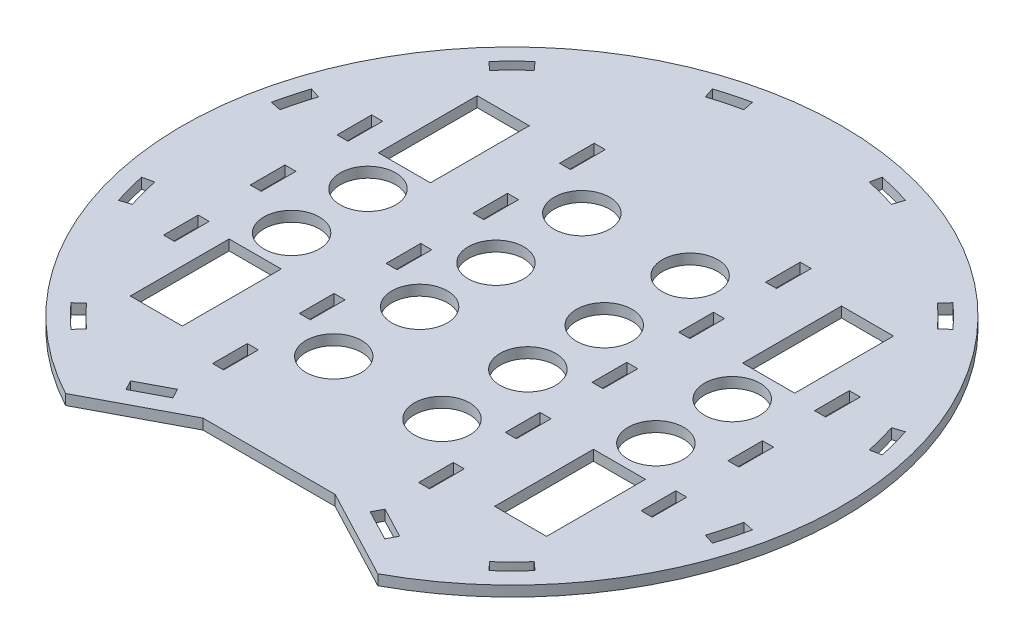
SolidWorks part; units mm, degrees
ref_plane "Front Plane" through (0, 0, 0) normal (0, 0, 1) x (1, 0, 0)
ref_plane "Top Plane" through (0, 0, 0) normal (0, 1, 0) x (1, 0, 0)
ref_plane "Right Plane" through (0, 0, 0) normal (1, 0, 0) x (0, 0, -1)
sketch "Sketch1" plane through (0, 0, 0) normal (0, 1, 0) x (1, 0, 0)
  line L0 (-106.3364, -157.4566) -> (-42.1421, -123.65) construction
  line L1 (-120, -100.0099) -> (-90, -100.0099)
  line L2 (-120, -100.0099) -> (-120, -43.0099)
  line L3 (-120, -43.0099) -> (-90, -43.0099)
  line L4 (-90, -100.0099) -> (-90, -43.0099)
  line L5 (-120, 43.0099) -> (-90, 43.0099)
  line L6 (-120, 43.0099) -> (-120, 100.0099)
  line L7 (-120, 100.0099) -> (-90, 100.0099)
  line L8 (-90, 43.0099) -> (-90, 100.0099)
  line L9 (90, 100.0099) -> (120, 100.0099)
  line L10 (90, 100.0099) -> (90, 43.0099)
  line L11 (90, 43.0099) -> (120, 43.0099)
  line L12 (120, 100.0099) -> (120, 43.0099)
  line L13 (120, -43.0099) -> (90, -43.0099)
  line L14 (120, -43.0099) -> (120, -100.0099)
  line L15 (120, -100.0099) -> (90, -100.0099)
  line L16 (90, -43.0099) -> (90, -100.0099)
  line L17 (-42.1421, -123.65) -> (42.1421, -123.65) construction
  line L18 (0, 190) -> (0, -190) construction
  line L19 (-105, 43.0099) -> (-105, -43.0099) construction
  line L20 (-190, 0) -> (190, 0) construction
  line L33 (140.85, -40) -> (140.85, -60)
  line L34 (-134.5, 40) -> (-140.85, 40)
  line L35 (-134.5, 40) -> (-134.5, 60)
  line L36 (-134.5, 60) -> (-140.85, 60)
  line L37 (-140.85, 40) -> (-140.85, 60)
  line L38 (-134.5, 10) -> (-140.85, 10)
  line L39 (-134.5, 10) -> (-134.5, -10)
  line L40 (-134.5, -10) -> (-140.85, -10)
  line L41 (-140.85, 10) -> (-140.85, -10)
  line L46 (-134.5, -40) -> (-140.85, -40)
  line L47 (-134.5, -40) -> (-134.5, -60)
  line L48 (-134.5, -60) -> (-140.85, -60)
  line L49 (-140.85, -40) -> (-140.85, -60)
  line L50 (134.5, -60) -> (140.85, -60)
  line L51 (134.5, -40) -> (134.5, -60)
  line L52 (134.5, -40) -> (140.85, -40)
  line L53 (140.85, 10) -> (140.85, -10)
  line L54 (134.5, -10) -> (140.85, -10)
  line L55 (134.5, 10) -> (134.5, -10)
  line L56 (134.5, 10) -> (140.85, 10)
  line L57 (140.85, 40) -> (140.85, 60)
  line L58 (134.5, 60) -> (140.85, 60)
  line L59 (134.5, 40) -> (134.5, 60)
  line L60 (134.5, 40) -> (140.85, 40)
  line L73 (42.1421, -123.65) -> (106.3364, -157.4566) construction
  line L86 (0, 0) -> (-37.4241, 176.0666) construction
  line L99 (-155.3051, -190) -> (147.1552, -190) construction
  line L100 (-128.4523, -140) -> (128.4523, -140) construction
  line L101 (-90, -167.332) -> (-38.1, -140)
  line L102 (-38.1, -140) -> (38.1, -140)
  line L103 (38.1, -140) -> (90, -167.332)
  line L104 (-53.6608, 165.151) -> (-55.6231, 171.1902)
  line L105 (0, 0) -> (-55.6231, 171.1902) construction
  line L126 (105, 43.0099) -> (105, -43.0099) construction
  line L127 (-37.4241, 176.0666) -> (-36.1039, 169.8553)
  line L128 (-100.2255, -161.4151) -> (-40.5722, -130) construction
  line L129 (-120.4435, 133.7661) -> (-116.1945, 129.0471)
  line L130 (-40.5722, -130) -> (40.5722, -130) construction
  line L131 (40.5722, -130) -> (100.2255, -161.4151) construction
  line L132 (-129.0471, 116.1945) -> (-133.7661, 120.4435)
  line L133 (-171.1902, 55.6231) -> (-165.151, 53.6608)
  line L134 (-169.8553, 36.1039) -> (-176.0666, 37.4241)
  line L135 (-176.0666, -37.4241) -> (-169.8553, -36.1039)
  line L136 (-165.151, -53.6608) -> (-171.1902, -55.6231)
  line L137 (-133.7661, -120.4435) -> (-129.0471, -116.1945)
  line L138 (-116.1945, -129.0471) -> (-120.4435, -133.7661)
  line L139 (0, 0) -> (-36.1039, 169.8553) construction
  line L140 (56.2033, -10) -> (62.5533, -10)
  line L141 (116.1945, -129.0471) -> (120.4435, -133.7661)
  line L142 (133.7661, -120.4435) -> (129.0471, -116.1945)
  line L143 (165.151, -53.6608) -> (171.1902, -55.6231)
  line L144 (176.0666, -37.4241) -> (169.8553, -36.1039)
  line L145 (169.8553, 36.1039) -> (176.0666, 37.4241)
  line L146 (171.1902, 55.6231) -> (165.151, 53.6608)
  line L147 (129.0471, 116.1945) -> (133.7661, 120.4435)
  line L148 (120.4435, 133.7661) -> (116.1945, 129.0471)
  line L149 (37.4241, 176.0666) -> (36.1039, 169.8553)
  line L150 (53.6608, 165.151) -> (55.6231, 171.1902)
  line L151 (-56.8793, -138.5878) -> (-59.8381, -132.9693)
  line L152 (-59.8381, -132.9693) -> (-77.5342, -142.2885)
  line L153 (-77.5342, -142.2885) -> (-74.5754, -147.907)
  line L154 (-74.5754, -147.907) -> (-56.8793, -138.5878)
  line L155 (77.5342, -142.2885) -> (74.5754, -147.907)
  line L156 (74.5754, -147.907) -> (56.8793, -138.5878)
  line L157 (56.8793, -138.5878) -> (59.8381, -132.9693)
  line L158 (59.8381, -132.9693) -> (77.5342, -142.2885)
  line L159 (-62.5533, 40) -> (-56.2033, 40)
  line L164 (-56.2033, 10) -> (-62.5533, 10)
  line L165 (-56.2033, 10) -> (-56.2033, -10)
  line L166 (-56.2033, -10) -> (-62.5533, -10)
  line L167 (-62.5533, 10) -> (-62.5533, -10)
  line L168 (-62.5533, 40) -> (-62.5533, 60)
  line L169 (-62.5533, 60) -> (-56.2033, 60)
  line L170 (-56.2033, 40) -> (-56.2033, 60)
  line L171 (-62.5533, 90) -> (-56.2033, 90)
  line L172 (-62.5533, 90) -> (-62.5533, 110)
  line L173 (-62.5533, 110) -> (-56.2033, 110)
  line L174 (-56.2033, 90) -> (-56.2033, 110)
  line L175 (-62.5533, -40) -> (-56.2033, -40)
  line L176 (-62.5533, -40) -> (-62.5533, -60)
  line L177 (-62.5533, -60) -> (-56.2033, -60)
  line L178 (-56.2033, -40) -> (-56.2033, -60)
  line L179 (-62.5533, -90) -> (-56.2033, -90)
  line L180 (-62.5533, -90) -> (-62.5533, -110)
  line L181 (-62.5533, -110) -> (-56.2033, -110)
  line L182 (-56.2033, -90) -> (-56.2033, -110)
  line L183 (62.5533, -60) -> (56.2033, -60)
  line L184 (56.2033, -40) -> (56.2033, -60)
  line L185 (62.5533, -40) -> (62.5533, -60)
  line L186 (62.5533, -40) -> (56.2033, -40)
  line L187 (62.5533, -110) -> (56.2033, -110)
  line L188 (62.5533, -90) -> (56.2033, -90)
  line L189 (56.2033, -90) -> (56.2033, -110)
  line L190 (62.5533, -90) -> (62.5533, -110)
  line L191 (56.2033, 90) -> (56.2033, 110)
  line L192 (62.5533, 110) -> (56.2033, 110)
  line L193 (62.5533, 90) -> (62.5533, 110)
  line L194 (62.5533, 90) -> (56.2033, 90)
  line L195 (56.2033, 40) -> (56.2033, 60)
  line L196 (62.5533, 60) -> (56.2033, 60)
  line L197 (62.5533, 40) -> (62.5533, 60)
  line L198 (62.5533, 10) -> (62.5533, -10)
  line L199 (56.2033, 10) -> (56.2033, -10)
  line L200 (56.2033, 10) -> (62.5533, 10)
  line L201 (62.5533, 40) -> (56.2033, 40)
  line L202 (-134.5, -60) -> (-134.5, -109.8366) construction
  line L203 (-134.5, 60) -> (-134.5, 109.8366) construction
  line L204 (-56.2033, 110) -> (-56.2033, 164.3031) construction
  line L205 (-56.2033, -110) -> (-56.2033, -131.0551) construction
  circle A0 centre (0, 0) radius 190 construction
  arc A3 (-90, -167.332) -> (90, -167.332) centre (0, 0) cw
  circle A4 centre (-105, -22.0099) radius 16
  circle A5 centre (-105, 22.0099) radius 16
  circle A6 centre (105, 22.0099) radius 16
  circle A7 centre (105, -22.0099) radius 16
  circle A16 centre (0, 0) radius 180 construction
  circle A17 centre (0, 0) radius 173.65 construction
  arc A18 (-55.6231, 171.1902) -> (-37.4241, 176.0666) centre (0, 0) cw
  arc A19 (-53.6608, 165.151) -> (-36.1039, 169.8553) centre (0, 0) cw
  arc A20 (-133.7661, 120.4435) -> (-120.4435, 133.7661) centre (0, 0) cw
  arc A21 (-129.0471, 116.1945) -> (-116.1945, 129.0471) centre (0, 0) cw
  arc A22 (-176.0666, 37.4241) -> (-171.1902, 55.6231) centre (0, 0) cw
  arc A23 (-169.8553, 36.1039) -> (-165.151, 53.6608) centre (0, 0) cw
  arc A24 (-171.1902, -55.6231) -> (-176.0666, -37.4241) centre (0, 0) cw
  arc A25 (-165.151, -53.6608) -> (-169.8553, -36.1039) centre (0, 0) cw
  arc A26 (-120.4435, -133.7661) -> (-133.7661, -120.4435) centre (0, 0) cw
  arc A27 (-116.1945, -129.0471) -> (-129.0471, -116.1945) centre (0, 0) cw
  arc A28 (120.4435, -133.7661) -> (133.7661, -120.4435) centre (0, 0) ccw
  arc A29 (116.1945, -129.0471) -> (129.0471, -116.1945) centre (0, 0) ccw
  arc A30 (165.151, -53.6608) -> (169.8553, -36.1039) centre (0, 0) ccw
  arc A31 (171.1902, -55.6231) -> (176.0666, -37.4241) centre (0, 0) ccw
  arc A32 (176.0666, 37.4241) -> (171.1902, 55.6231) centre (0, 0) ccw
  arc A33 (169.8553, 36.1039) -> (165.151, 53.6608) centre (0, 0) ccw
  arc A34 (133.7661, 120.4435) -> (120.4435, 133.7661) centre (0, 0) ccw
  arc A35 (129.0471, 116.1945) -> (116.1945, 129.0471) centre (0, 0) ccw
  arc A36 (53.6608, 165.151) -> (36.1039, 169.8553) centre (0, 0) ccw
  arc A37 (55.6231, 171.1902) -> (37.4241, 176.0666) centre (0, 0) ccw
  circle A38 centre (-31.2033, 22.0099) radius 16
  circle A39 centre (-31.2033, 71.5099) radius 16
  circle A40 centre (-31.2033, -22.0099) radius 16
  circle A41 centre (-31.2033, -71.5099) radius 16
  circle A42 centre (31.2033, -71.5099) radius 16
  circle A43 centre (31.2033, -22.0099) radius 16
  circle A44 centre (31.2033, 71.5099) radius 16
  circle A45 centre (31.2033, 22.0099) radius 16
  point P71 (-59.3783, 90)
  point P116 (0, -140)
  point P166 (-90, -71.5099)
  point P168 (-90, 71.5099)
  point P182 (0, 0)
  point P184 (-56.2033, 164.3031)
  point P194 (0, 0)
  point P195 (-56.2033, -131.0551)
  point P199 (-56.2033, 0)
  dimension "D1" = 380
  dimension "D5" = 90
  dimension "D25" = 32
  dimension "D30" = 360
  dimension "D31" = 347.3
  dimension "D38" = 20
  dimension "D3" = 30
  dimension "D4" = 57
  dimension "D6" = 6.35
  dimension "D7" = 71.9467
  dimension "D8" = 20
  dimension "D9" = 30
  dimension "D10" = 30
  dimension "D11" = 30
  dimension "D12" = 14.5
  dimension "D13" = 200.0199
  dimension "D14" = 100.0099
  dimension "D15" = 90
  dimension "D16" = 6.35
  dimension "D17" = 50
  dimension "D18" = 76.2
  dimension "D19" = 6.35
  dimension "D20" = 6.35
  dimension "D21" = 30
  dimension "D22" = 30
  dimension "D23" = 54.3031
  dimension "D24" = 49.8366
  dimension "D26" = 21
  dimension "D27" = 21
  dimension "D28" = 6
  dimension "D29" = 12
  dimension "D32" = 10
  dimension "D33" = 10
  dimension "D34" = 10
  dimension "D35" = 5
  dimension "D36" = 49.8366
  dimension "D37" = 21.0551
  dimension "D39" = 20
  dimension "D41" = 20
extrude "Boss-Extrude1" add sketch "Sketch1" along normal blind 6
